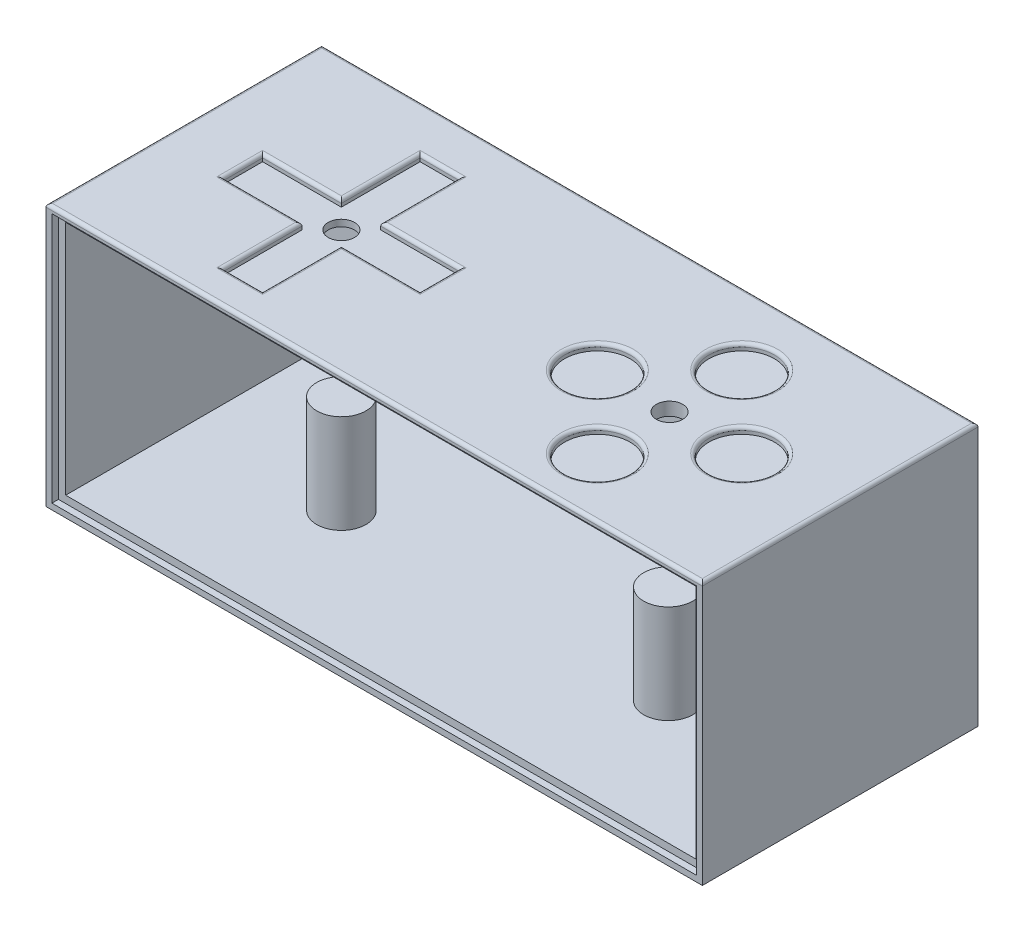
SolidWorks part; units mm, degrees
ref_plane "Ebene vorne" through (0, 0, 0) normal (0, 0, 1) x (1, 0, 0)
ref_plane "Ebene oben" through (0, 0, 0) normal (0, 1, 0) x (1, 0, 0)
ref_plane "Ebene rechts" through (0, 0, 0) normal (1, 0, 0) x (0, 0, -1)
sketch "Skizze1" plane through (0, 0, 0) normal (0, 0, 1) x (1, 0, 0)
  line L1 (-100, -40) -> (100, -40)
  line L2 (-100, -40) -> (-100, 40)
  line L3 (-100, 40) -> (100, 40)
  line L4 (100, -40) -> (100, 40)
  line L5 (-100, -40) -> (100, 40) construction
  line L6 (-100, 40) -> (100, -40) construction
  point P0 (0, 0)
  dimension "D1" = 200
  dimension "D2" = 80
extrude "Aufsatz-Linear austragen1" add sketch "Skizze1" along normal blind 4
sketch "Skizze2" plane through (0, 0, 4) normal (0, 0, 1) x (1, 0, 0)
  line L1 (-100, -40) -> (100, -40)
  line L2 (-100, -40) -> (-100, 40)
  line L3 (-100, 40) -> (100, 40)
  line L4 (100, -40) -> (100, 40)
  line L5 (-100, -40) -> (100, 40) construction
  line L6 (-100, 40) -> (100, -40) construction
  line L7 (-96, -36) -> (96, -36)
  line L8 (-96, -36) -> (-96, 36)
  line L9 (-96, 36) -> (96, 36)
  line L10 (96, -36) -> (96, 36)
  line L11 (-96, -36) -> (96, 36) construction
  line L12 (-96, 36) -> (96, -36) construction
  point P0 (0, 0)
  point P7 (0, 0)
  dimension "D1" = 4
  dimension "D2" = 4
extrude "Aufsatz-Linear austragen2" add sketch "Skizze2" along normal blind 80 contours L2 L1 L4 L3 | L8 L7 L10 L9
sketch "Skizze3" plane through (0, 0, 84) normal (0, 0, 1) x (1, 0, 0)
  line L0 (0, 40) -> (0, -40) construction
  line L1 (-100, 40) -> (100, 40) construction
  line L2 (-100, -40) -> (100, -40) construction
  line L3 (100, -40) -> (100, 40) construction
  line L4 (-98.2, -38.2) -> (98.2, -38.2)
  line L5 (-98.2, -38.2) -> (-98.2, 38.2)
  line L6 (-98.2, 38.2) -> (98.2, 38.2)
  line L7 (98.2, -38.2) -> (98.2, 38.2)
  line L8 (-98.2, -38.2) -> (98.2, 38.2) construction
  line L9 (-98.2, 38.2) -> (98.2, -38.2) construction
  point P6 (0, 0)
  dimension "D1" = 1.8
  dimension "D2" = 1.8
extrude "Schnitt-Linear austragen1" cut sketch "Skizze3" against normal blind 2
sketch "Skizze4" plane through (0, 40, 0) normal (0, 1, 0) x (1, 0, 0)
  line L0 (-100, -44) -> (100, -44) construction
  line L1 (-100, -84) -> (-100, 0) construction
  line L2 (100, -84) -> (100, 0) construction
  line L3 (100, -40) -> (-100, -40) construction
  line L4 (-100, -84) -> (100, -84) construction
  line L5 (-50, 0) -> (-50, -84) construction
  line L6 (100, 0) -> (-100, 0) construction
  line L7 (0, 0) -> (0, -84) construction
  line L8 (50, 0) -> (50, -84) construction
  line L10 (-80, -50) -> (-20, -50)
  line L11 (-80, -50) -> (-80, -38)
  line L12 (-80, -38) -> (-20, -38)
  line L13 (-20, -50) -> (-20, -38)
  line L14 (-80, -50) -> (-20, -38) construction
  line L15 (-80, -38) -> (-20, -50) construction
  line L16 (-56, -74) -> (-44, -74)
  line L17 (-56, -74) -> (-56, -14)
  line L18 (-56, -14) -> (-44, -14)
  line L19 (-44, -74) -> (-44, -14)
  line L20 (-56, -74) -> (-44, -14) construction
  line L21 (-56, -14) -> (-44, -74) construction
  circle A0 centre (-50, -44) radius 4
  circle A1 centre (50, -44) radius 4
  circle A2 centre (28, -44) radius 10
  circle A3 centre (50, -22) radius 10
  circle A4 centre (50, -66) radius 10
  circle A5 centre (72, -44) radius 10
  dimension "D4" = 8
  dimension "D8" = 22
  dimension "D1" = 44
  dimension "D2" = 12
  dimension "D3" = 50
  dimension "D5" = 12
  dimension "D6" = 60
  dimension "D7" = 60
  dimension "D9" = 22
extrude "Schnitt-Linear austragen2" cut sketch "Skizze4" against normal blind 2 contours L10 L17 L12 L11 | L12 L19 L18 L17 | L19 L10 L13 L12 | L10 L19 L12 L17 A0 | L16 L19 L10 L17 | A4 | A2 | A3 | A5
fillet "Verrundung1" radius 1 20 edges at (-50, 40, 74) (-44, 40, 62) (-32, 40, 50) (-20, 40, 44) (-32, 40, 38) (-44, 40, 26) (-50, 40, 14) (-56, 40, 26) (-68, 40, 38) (-80, 40, 44) (-68, 40, 50) (-56, 40, 62) (50, 40, 32) (100, 40, 42) (0, 40, 84) (-100, 40, 42) (0, 40, 0) (50, 40, 76) (28, 40, 54) (72, 40, 54)
sketch "Skizze5" plane through (0, 40, 0) normal (0, 1, 0) x (1, 0, 0)
  line L0 (-50, -44) -> (99, -44) construction
  line L1 (99, -83) -> (99, -1) construction
  line L2 (50, -12) -> (50, -55) construction
  line L3 (41.2778, -44) -> (57.6874, -44) construction
  circle A0 centre (-50, -44) radius 4
  circle A1 centre (50, -22) radius 10 construction
  circle A2 centre (50, -66) radius 11 construction
  circle A3 centre (50, -44) radius 4
  dimension "D1" = 8
extrude "Schnitt-Linear austragen3" cut sketch "Skizze5" against normal blind 15
sketch "Skizze6" plane through (0, 0, 0) normal (0, 0, -1) x (-1, 0, 0)
  line L0 (0, -40) -> (0, 39) construction
  line L1 (100, -40) -> (-100, -40) construction
  line L2 (100, 39) -> (-100, 39) construction
  circle A0 centre (0, -30) radius 6
  dimension "D1" = 12
  dimension "D2" = 10
extrude "Schnitt-Linear austragen4" cut sketch "Skizze6" against normal blind 15
sketch "Skizze7" plane through (0, 40, 0) normal (0, 1, 0) x (1, 0, 0)
  line L0 (50, -40) -> (50, -48) construction
  circle A0 centre (-50, -44) radius 7.5
  circle A1 centre (50, -44) radius 4 construction
  circle A2 centre (50, -44.3831) radius 7.5
extrude "Aufsatz-Linear austragen3" add sketch "Skizze7" against normal blind 30 from offset 46
